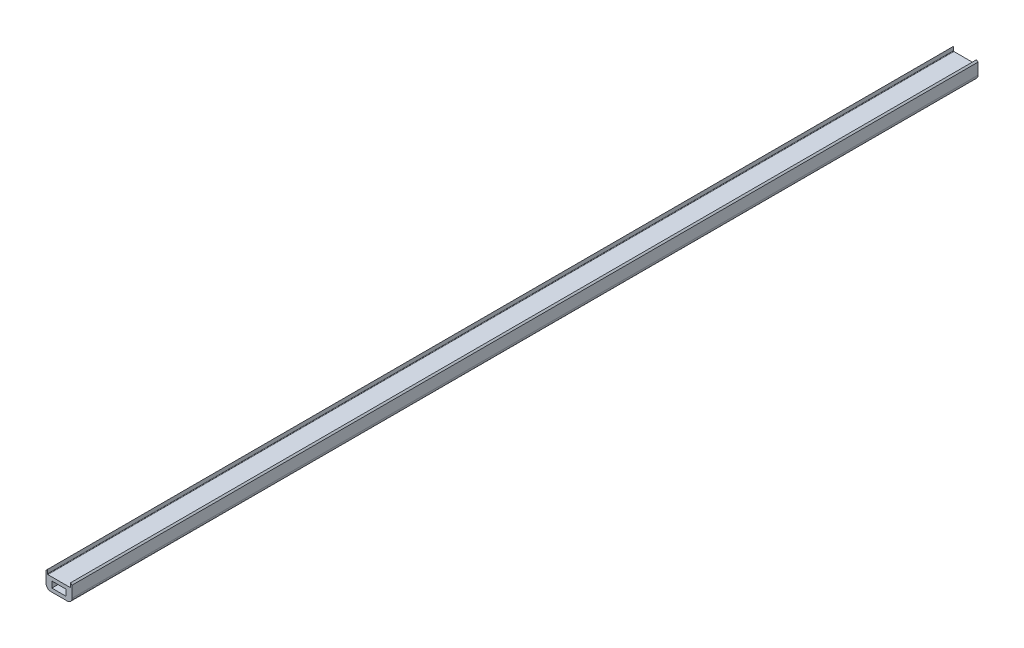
SolidWorks part; units mm, degrees
ref_plane "Front Plane" through (0, 0, 0) normal (0, 0, 1) x (1, 0, 0)
ref_plane "Top Plane" through (0, 0, 0) normal (0, 1, 0) x (1, 0, 0)
ref_plane "Right Plane" through (0, 0, 0) normal (1, 0, 0) x (0, 0, -1)
sketch "Sketch2" plane through (0, 0, 0) normal (0, 0, 1) x (1, 0, 0)
  line L0 (-24.5, 3.0277) -> (-27.5, 3.0277)
  line L1 (-27.5, 3.0277) -> (-27.5, -34.0023)
  line L2 (0, -6) -> (0, 3.0277) construction
  line L3 (-24.5, 3.0277) -> (-24.5, -5)
  line L4 (-23.5, -6) -> (23.5, -6)
  line L6 (27.5, -34.0023) -> (-27.5, -34.0023)
  line L7 (24.5, 3.0277) -> (24.5, -5)
  line L8 (27.5, 3.0277) -> (27.5, -34.0023)
  line L9 (24.5, 3.0277) -> (27.5, 3.0277)
  arc A1 (-23.5, -6) -> (-24.5, -5) centre (-23.5, -5) cw
  arc A2 (23.5, -6) -> (24.5, -5) centre (23.5, -5) ccw
  point P11 (-11.5, -21.6228)
  point P22 (11.5, -21.6228)
  dimension "D1" = 27.5
  dimension "D2" = 3
  dimension "D3" = 6
  dimension "D4" = 37.03
extrude "Boss-Extrude1" add sketch "Sketch2" along normal mid plane 1920
fillet "Fillet1" radius 10 2 edges at (27.5, -34.0023, 0) (-27.5, -34.0023, 0)
chamfer "Chamfer1" distance 3 angle 45 2 edges at (27.5, 3.0277, 0) (-27.5, 3.0277, 0)
sketch "Sketch5" plane through (0, 0, 960) normal (0, 0, 1) x (1, 0, 0)
  line L0 (0, -6) -> (0, -34.0023) construction
  line L1 (23.5, -6) -> (-23.5, -6) construction
  line L2 (-17.5, -34.0023) -> (17.5, -34.0023) construction
  line L4 (-15, -13.5011) -> (15, -13.5011)
  line L5 (-15, -13.5011) -> (-15, -26.5011)
  line L6 (-15, -26.5011) -> (15, -26.5011)
  line L7 (15, -13.5011) -> (15, -26.5011)
  line L8 (-15, -13.5011) -> (15, -26.5011) construction
  line L9 (-15, -26.5011) -> (15, -13.5011) construction
  point P6 (0, -20.0011)
  dimension "D1" = 13
  dimension "D2" = 30
extrude "Cut-Extrude1" cut sketch "Sketch5" against normal blind 2007
